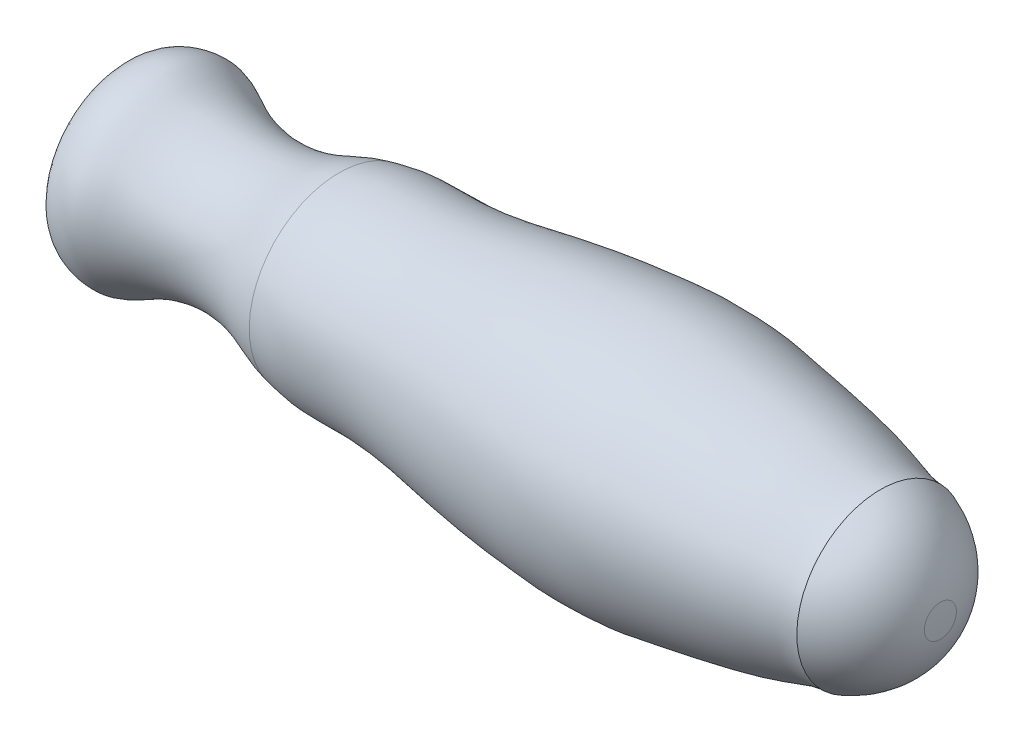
SolidWorks part; units mm, degrees
ref_plane "Front" through (0, 0, 0) normal (0, 0, 1) x (1, 0, 0)
ref_plane "Top" through (0, 0, 0) normal (0, 1, 0) x (1, 0, 0)
ref_plane "Right" through (0, 0, 0) normal (1, 0, 0) x (0, 0, -1)
sketch "Esquisse1" plane through (0, 0, 0) normal (0, 0, 1) x (1, 0, 0)
  line L0 (-5.4706, 0.3329) -> (111.2269, -11.1094) construction
  line L1 (0, 0) -> (0, -3.4014)
  line L2 (0, 0) -> (203.8198, 0.9847) construction
  line L4 (0, 0) -> (112, 0.5411)
  spline S0 degree 2 poles (0, -3.4014) (-0.1556, -7.1644) (0.5454, -10.8775) knots 0 0 0 1 1 1
  spline S1 degree 3 poles (0.5454, -10.8775) (1.3703, -11.9744) (3.3226, -12.8302) (6.1946, -12.9244) (8.2173, -11.8859) (10.5137, -10.6745) (13.2815, -9.8087) (16.632, -9.2235) (20.2629, -9.326) (24.1568, -10.1634) (27.1906, -11.5587) (29.1633, -12.0599) (29.7779, -12.2061) knots 0 0 0 0 0.120356 0.182103 0.252494 0.320379 0.416926 0.51167 0.625759 0.741662 0.867963 0.924774 0.924774 0.924774 0.924774
  spline S2 degree 3 poles (29.7779, -12.2061) (31.1346, -12.4504) (33.1676, -12.8911) (36.3876, -12.9051) (39.1715, -12.8799) (42.6259, -12.9791) (46.218, -13.347) (49.9167, -14.0068) (53.6218, -14.6405) (57.2662, -15.1744) (61.1202, -15.6812) (65.1405, -15.9976) (69.272, -16.4214) (73.6066, -16.3521) (77.7839, -16.2162) (81.9902, -15.5316) (86.3141, -14.804) (91.8474, -13.8515) (97.7509, -12.539) (101.9294, -10.9604) (103.8184, -10.9882) knots 0 0 0 0 0.055398 0.082677 0.128818 0.167035 0.221097 0.273334 0.317568 0.371734 0.420941 0.473294 0.533363 0.587168 0.646878 0.700632 0.757711 0.822668 0.925589 1 1 1 1
  spline S3 degree 3 poles (103.8184, -10.9882) (105.3866, -10.3956) (109.2102, -8.227) (111.463, -4.2308) (111.9223, -1.6522) knots 0 0 0 0 0.390825 1 1 1 1
  spline S8 degree 2 poles (112, 0.5411) (112.0053, -0.5553) (111.9223, -1.6522) knots 0.5 0.5 0.5 1 1 1
  point P4 (69.7283, -16.1677)
  point P17 (73.8825, -16.1677)
  point P30 (77.9798, -15.8262)
  point P34 (64.9481, -15.9969)
  point P36 (73.9963, -16.4522)
  point P38 (77.9229, -16.1107)
  point P40 (81.9064, -15.5417)
  point P42 (69.5576, -16.3953)
  point P44 (73.8758, -16.4365)
  point P46 (69.4314, -16.3439)
  point P48 (73.4592, -16.3439)
  dimension "D1" = 112
revolve "Révolution2" add sketch "Esquisse1" angle 360 about L4
